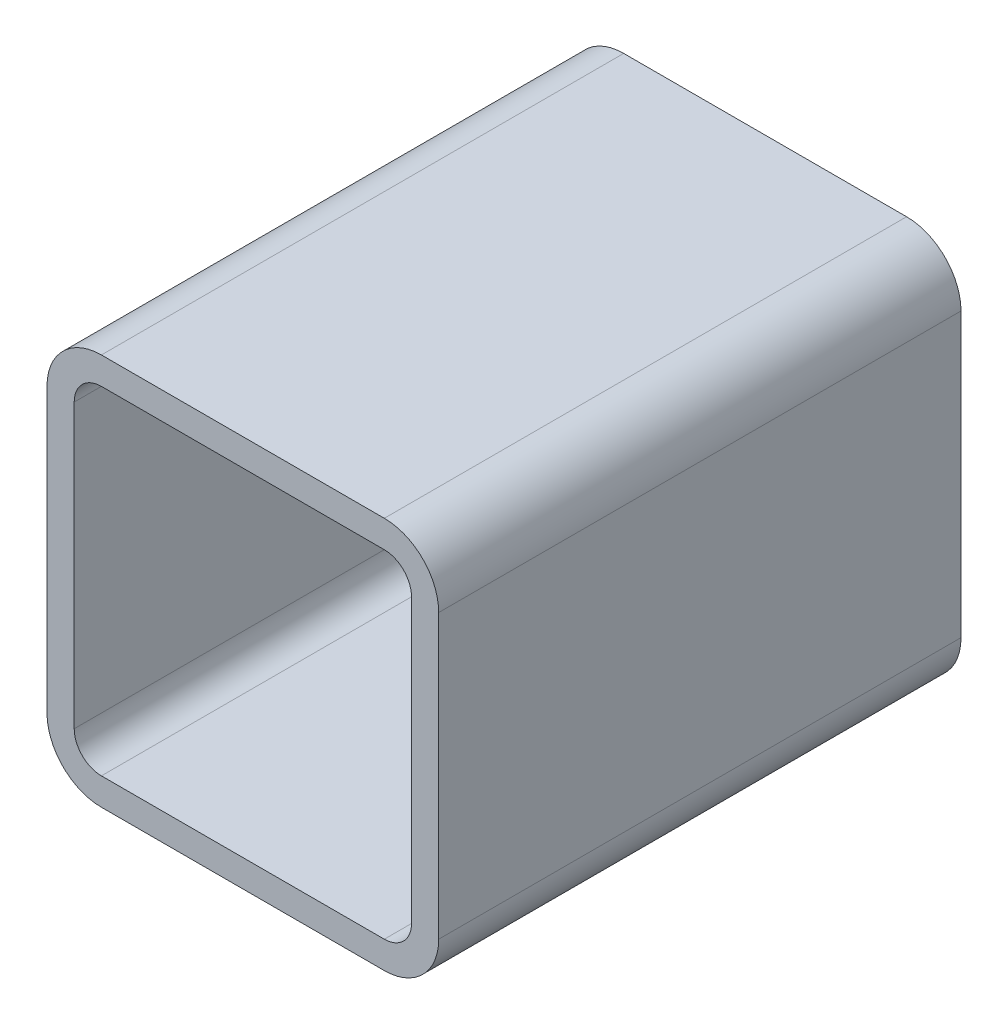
SolidWorks part; units mm, degrees
ref_plane "Front Plane" through (0, 0, 0) normal (0, 0, 1) x (1, 0, 0)
ref_plane "Top Plane" through (0, 0, 0) normal (0, 1, 0) x (1, 0, 0)
ref_plane "Right Plane" through (0, 0, 0) normal (1, 0, 0) x (0, 0, -1)
sketch "Sketch1" plane through (0, 0, 0) normal (0, 0, 1) x (1, 0, 0)
sketch_block_instance "HSS9x9x0.625-1"
sketch_block "HSS9x9x0.625"
extrude "Boss-Extrude1" add sketch "Sketch1" along normal blind 304.8
